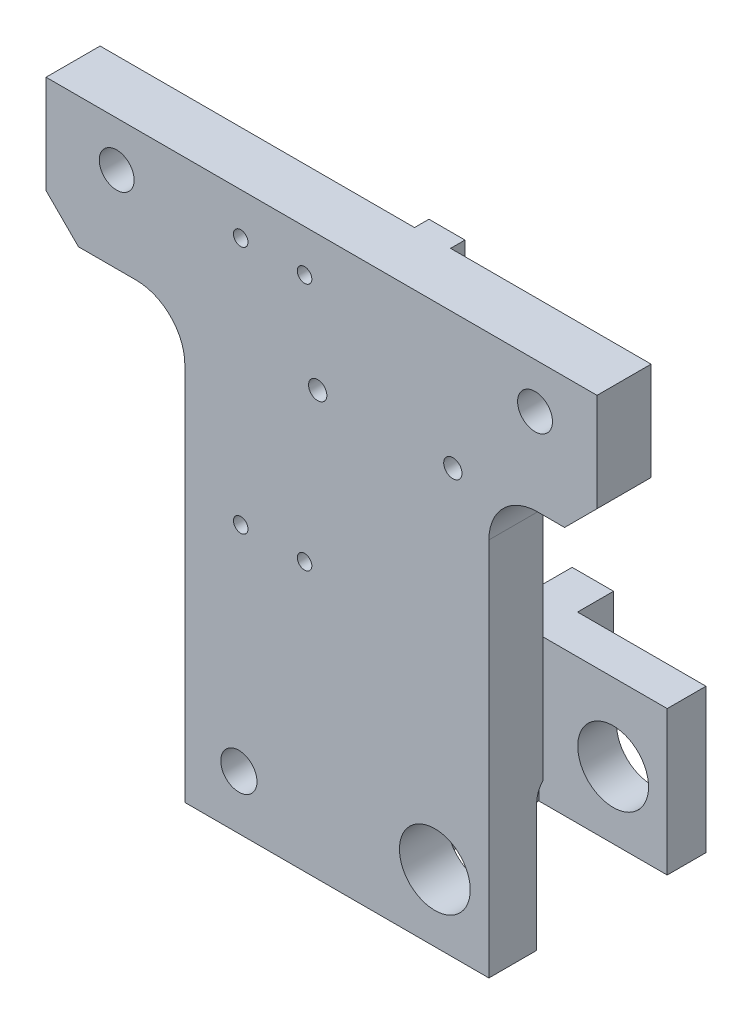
SolidWorks part; units mm, degrees
ref_plane "Front" through (0, 0, 0) normal (0, 0, 1) x (1, 0, 0)
ref_plane "Top" through (0, 0, 0) normal (0, 1, 0) x (1, 0, 0)
ref_plane "Right" through (0, 0, 0) normal (1, 0, 0) x (0, 0, -1)
sketch "Sketch1" plane through (0, 0, 0) normal (0, 0, 1) x (1, 0, 0)
  line L0 (-12.3787, 0) -> (-12.3787, 420) construction
  line L1 (-12.3787, 58.42) -> (30.48, 58.42)
  line L2 (-12.3787, 58.42) -> (-12.3787, -20.32)
  line L3 (-12.3787, -20.32) -> (30.48, -20.32)
  line L4 (30.48, 58.42) -> (30.48, -20.32)
  dimension "D1" = 58.42
  dimension "D2" = 20.32
  dimension "D3" = 30.48
extrude "Extrude1" add sketch "Sketch1" along normal blind 7.62
sketch "Sketch3" plane through (0, 0, 0) normal (0, 0, -1) x (-1, 0, 0)
  line L0 (12.3787, 58.42) -> (12.3787, -20.32) construction
  line L1 (12.3787, 0) -> (-12.3787, 0)
  line L2 (12.3787, 0) -> (12.3787, -20.32)
  line L3 (12.3787, -20.32) -> (-12.3787, -20.32)
  line L4 (-12.3787, 0) -> (-12.3787, -20.32)
  line L5 (12.3787, -20.32) -> (-30.48, -20.32) construction
  line L6 (-12.3787, 0) -> (-12.3787, 420) construction
  line L7 (-12.3787, 0) -> (12.3787, 0) construction
extrude "Extrude2" add sketch "Sketch3" along normal up to surface (17.511 mm away)
sketch "Sketch5" plane through (0, 0, 0) normal (0, 0, -1) x (-1, 0, 0)
  line L0 (-30.48, -20.32) -> (-30.48, 58.42) construction
  line L1 (-12.3787, -20.32) -> (-30.48, -20.32)
  line L2 (-12.3787, -20.32) -> (-12.3787, 0)
  line L3 (-12.3787, 0) -> (-30.48, 0)
  line L4 (-30.48, -20.32) -> (-30.48, 0)
  line L8 (12.3787, 0) -> (-12.3787, 0) construction
extrude "Cut-Extrude2" cut sketch "Sketch5" against normal blind 0.889
fillet "Fillet1" radius 3.556 1 edges at (21.4293, 0, 0.889)
sketch "Sketch4" plane through (0, 0, -17.511) normal (0, 0, -1) x (-1, 0, 0)
  line L0 (12.3787, 0) -> (-12.3787, 0) construction
  line L1 (12.3787, -20.32) -> (-30.48, -20.32)
  line L2 (12.3787, -20.32) -> (12.3787, 0)
  line L3 (12.3787, 0) -> (-30.48, 0)
  line L4 (-30.48, -20.32) -> (-30.48, 0)
  line L5 (-30.48, 0) -> (-30.48, 58.42) construction
extrude "Extrude3" add sketch "Sketch4" along normal blind 5.461
sketch "Sketch6" plane through (0, 0, 0) normal (0, 0, 1) x (1, 0, 0)
  line L1 (30.48, 58.42) -> (45.72, 58.42)
  line L2 (30.48, 58.42) -> (30.48, 40.005)
  line L3 (30.48, 40.005) -> (45.72, 40.005)
  line L4 (45.72, 58.42) -> (45.72, 40.005)
  dimension "D1" = 18.415
  dimension "D2" = 15.24
extrude "Extrude4" add sketch "Sketch6" along normal up to surface (7.62 mm away)
sketch "Sketch7" plane through (0, 0, 0) normal (0, 0, 1) x (1, 0, 0)
  line L0 (30.48, 40.005) -> (45.72, 40.005) construction
  line L1 (-12.3787, 58.42) -> (-31.9367, 58.42)
  line L2 (-12.3787, 58.42) -> (-12.3787, 40.005)
  line L3 (-12.3787, 40.005) -> (-31.9367, 40.005)
  line L4 (-31.9367, 58.42) -> (-31.9367, 40.005)
  dimension "D1" = 19.558
extrude "Extrude5" add sketch "Sketch7" along normal up to surface (7.62 mm away)
fillet "Fillet2" radius 6.858 2 edges at (30.48, 40.005, 3.81)
sketch "Sketch8" plane through (0, 0, -22.972) normal (0, 0, -1) x (-1, 0, 0)
  line L1 (12.3787, -20.32) -> (-6.0287, -20.32)
  line L2 (12.3787, -20.32) -> (12.3787, 0)
  line L3 (12.3787, 0) -> (-6.0287, 0)
  line L4 (-6.0287, -20.32) -> (-6.0287, 0)
  line L6 (-12.3787, 0) -> (-12.3787, -20.32) construction
  dimension "D1" = 6.35
extrude "Cut-Extrude3" cut sketch "Sketch8" against normal up to surface (19.772 mm away)
chamfer "Chamfer1" [suppressed] distance 5.08 angle 45
sketch "Sketch9" plane through (0, 0, 0) normal (0, 0, -1) x (-1, 0, 0)
  line L0 (-45.72, 58.42) -> (31.9367, 58.42) construction
  line L1 (-17.4587, 58.42) -> (-12.3787, 58.42)
  line L2 (-17.4587, 58.42) -> (-17.4587, 9.906)
  line L3 (-17.4587, 9.906) -> (-12.3787, 9.906)
  line L4 (-12.3787, 58.42) -> (-12.3787, 9.906)
  line L5 (-12.3787, 0) -> (-12.3787, 420) construction
  line L6 (12.3787, 0) -> (-12.3787, 0) construction
  dimension "D1" = 5.08
  dimension "D2" = 9.906
extrude "Extrude6" add sketch "Sketch9" along normal blind 2.032
sketch "Sketch10" plane through (0, 0, 7.62) normal (0, 0, 1) x (1, 0, 0)
  circle A0 centre (22.86, -10.89) radius 4.9911
  circle A1 centre (22.86, -10.89) radius 5 construction
  dimension "D1" = 9.9822
extrude "Cut-Extrude4" cut sketch "Sketch10" against normal through all
chamfer "Chamfer2" distance 4.572 angle 45 2 edges at (45.72, 40.005, 3.81) (-31.9367, 40.005, 3.81)
sketch "Sketch19" plane through (0, 0, -22.972) normal (0, 0, -1) x (-1, 0, 0)
  line L1 (-6.0287, 0) -> (-12.3787, 0)
  line L2 (-6.0287, 0) -> (-6.0287, -20.32)
  line L3 (-6.0287, -20.32) -> (-12.3787, -20.32)
  line L4 (-12.3787, 0) -> (-12.3787, -20.32)
extrude "Extrude7" add sketch "Sketch19" along normal blind 5.08
hole_wizard "#10 (0.1935) Diameter Hole1" positions "Sketch12" profile "Sketch11" hole size "#10" standard "Ansi Inch"
sketch "Sketch12" plane through (0, 0, 0) normal (0, 0, -1) x (-1, 0, 0)
  line L0 (-12.3787, 58.42) -> (31.9367, 58.42) construction
  line L1 (31.9367, 58.42) -> (31.9367, 44.577) construction
  line L2 (-45.72, 58.42) -> (-17.4587, 58.42) construction
  line L3 (-45.72, 44.577) -> (-45.72, 58.42) construction
  point P0 (21.9799, 52.07)
  point P1 (-36.9824, 52.07)
  dimension "D1" = 6.35
  dimension "D2" = 9.9568
  dimension "D3" = 6.35
  dimension "D4" = 8.7376
sketch "Sketch11" plane through (-21.9799, 52.07, 0) normal (1, 0, 0) x (0, 1, 0)
  line L0 (0, 0) -> (0, 7.62)
  line L1 (0, 7.62) -> (2.4574, 7.62)
  line L2 (2.4574, 7.62) -> (2.4574, 0)
  line L5 (2.4574, 0) -> (0, 0)
  line L11 (0, -6.35) -> (0, 107.95) construction
  dimension "Thru Hole Dia." = 4.9149
  dimension "Thru Hole Depth" = 7.62
hole_wizard "M2.5x0.45 Tapped Hole1" positions "Sketch14" profile "Sketch13" tap size "M2.5x0.45" standard "Ansi Metric"
sketch "Sketch14" plane through (0, 0, 0) normal (0, 0, -1) x (-1, 0, 0)
  circle A0 centre (4.5, 52.5) radius 1.45 construction
  circle A1 centre (-4.5, 52.5) radius 1.45 construction
  circle A2 centre (4.5, 17.5) radius 1.45 construction
  circle A3 centre (-4.5, 17.5) radius 1.45 construction
  point P0 (4.5, 52.5)
  point P1 (-4.5, 52.5)
  point P2 (-4.5, 17.5)
  point P3 (4.5, 17.5)
sketch "Sketch13" plane through (-4.5, 52.5, 0) normal (1, 0, 0) x (0, 1, 0)
  line L0 (0, 0) -> (0, 7.62)
  line L1 (0, 7.62) -> (1.025, 7.62)
  line L2 (1.025, 7.62) -> (1.025, 0)
  line L5 (1.025, 0) -> (0, 0)
  line L11 (0, -6.35) -> (0, 107.95) construction
  dimension "Thru Tap Drill Dia." = 2.05
  dimension "Thru Tap Drill Depth" = 7.62
hole_wizard "#5-40 Tapped Hole1" positions "Sketch16" profile "Sketch15" tap size "#5-40" standard "Ansi Inch"
sketch "Sketch16" plane through (6.0287, 0, 0) normal (-1, 0, 0) x (0, 0, 1)
  circle A1 centre (-6.3838, -4.445) radius 1.6319 construction
  circle A2 centre (-25.4338, -4.445) radius 1.6319 construction
  point P0 (-25.4338, -4.445)
  point P1 (-6.3838, -4.445)
sketch "Sketch15" plane through (6.0287, -4.445, -25.4338) normal (0, 1, 0) x (0, 0, 1)
  line L0 (0, 0) -> (0, 39.6913)
  line L1 (0, 39.6913) -> (1.289, 39.6913)
  line L2 (1.289, 39.6913) -> (1.289, 0)
  line L5 (1.289, 0) -> (0, 0)
  line L11 (0, -6.35) -> (0, 107.95) construction
  dimension "Thru Tap Drill Dia." = 2.5781
  dimension "Thru Tap Drill Depth" = 39.6913
hole_wizard "#4-40 Tapped Hole1" positions "Sketch18" profile "Sketch17" tap size "#4-40" standard "Ansi Inch"
sketch "Sketch18" plane through (-12.3787, 0, 0) normal (-1, 0, 0) x (0, 0, 1)
  circle A0 centre (4.445, -3.175) radius 1.4732 construction
  circle A1 centre (4.445, 13.335) radius 1.4732 construction
  circle A2 centre (4.445, 29.845) radius 1.4732 construction
  point P0 (4.445, -3.175)
  point P1 (4.445, 13.335)
  point P2 (4.445, 29.845)
sketch "Sketch17" plane through (-12.3787, -3.175, 4.445) normal (0, 1, 0) x (0, 0, 1)
  line L0 (0, 0) -> (0, 11.2202)
  line L1 (0, 11.2202) -> (1.1303, 10.541)
  line L2 (1.1303, 10.541) -> (1.1303, 0)
  line L5 (1.1303, 0) -> (0, 0)
  line L10 (0, 11.2202) -> (-1.1303, 10.541) construction
  line L11 (0, -6.35) -> (0, 107.95) construction
  dimension "Tap Drill Dia." = 2.2606
  dimension "Tap Drill Depth" = 10.541
  dimension "Drill Angle" = 118
hole_wizard "CBORE for #10 Socket Head Cap Screw1" positions "Sketch21" profile "Sketch20" counterbore size "#10" standard "Ansi Inch"
sketch "Sketch21" plane through (0, 0, -3.2) normal (0, 0, -1) x (-1, 0, 0)
  line L0 (-6.0287, -20.32) -> (12.3787, -20.32) construction
  line L1 (12.3787, -20.32) -> (12.3787, 0) construction
  point P0 (4.7587, -12.7)
  dimension "D1" = 7.62
  dimension "D2" = 7.62
sketch "Sketch20" plane through (-4.7587, -12.7, -3.2) normal (1, 0, 0) x (0, 1, 0)
  line L0 (0, 0) -> (0, 10.82)
  line L1 (0, 10.82) -> (2.5527, 10.82)
  line L3 (2.5527, 10.82) -> (2.5527, 5.842)
  line L4 (2.5527, 5.842) -> (4.7625, 5.842)
  line L5 (4.7625, 5.842) -> (4.7625, 0)
  line L7 (4.7625, 0) -> (0, 0)
  line L11 (0, -6.35) -> (0, 107.95) construction
  dimension "Thru Hole Dia." = 5.1054
  dimension "Thru Hole Depth" = 10.82
  dimension "C'Bore Dia." = 9.525
  dimension "C'Bore Depth" = 5.842
sketch "Sketch22" plane through (6.0287, 0, 0) normal (-1, 0, 0) x (0, 0, 1)
  line L1 (-3.2, 0) -> (-28.052, 0)
  line L2 (-3.2, 0) -> (-3.2, -20.32)
  line L3 (-3.2, -20.32) -> (-28.052, -20.32)
  line L4 (-28.052, 0) -> (-28.052, -20.32)
extrude "Cut-Extrude5" cut sketch "Sketch22" against normal blind 0.508
sketch "Sketch23" plane through (6.5367, 0, 0) normal (-1, 0, 0) x (0, 0, 1)
  line L1 (-13.1148, 0) -> (-9.0508, 0)
  line L2 (-13.1148, 0) -> (-13.1148, -8.255)
  line L3 (-13.1148, -8.255) -> (-9.0508, -8.255)
  line L4 (-9.0508, 0) -> (-9.0508, -8.255)
  line L6 (-9.5588, -1.27) -> (-9.5588, -7.62) construction
  line L7 (-3.4628, -7.62) -> (-9.5588, -7.62) construction
  line L8 (-3.2, 0) -> (-28.052, 0) construction
  dimension "D1" = 4.064
  dimension "D2" = 0.635
  dimension "D3" = 0.508
extrude "Cut-Extrude6" cut sketch "Sketch23" against normal through all
fillet "Fillet3" radius 1.778 2 edges at (9.4577, -8.255, -13.1148) (9.4577, -8.255, -9.0508)
sketch "Sketch24" plane through (0, 0, -3.2) normal (0, 0, -1) x (-1, 0, 0)
  line L0 (-6.5367, -20.32) -> (-6.5367, 0) construction
  line L1 (-6.5367, -20.32) -> (-3.2347, -20.32)
  line L2 (-6.5367, -20.32) -> (-6.5367, -12.065)
  line L3 (-6.5367, -12.065) -> (-3.2347, -12.065)
  line L4 (-3.2347, -20.32) -> (-3.2347, -12.065)
  line L5 (-6.5367, -20.32) -> (12.3787, -20.32) construction
  dimension "D1" = 8.255
  dimension "D2" = 3.302
extrude "Extrude8" add sketch "Sketch24" along normal up to surface (24.852 mm away)
fillet "Fillet4" radius 3.556 1 edges at (6.5367, -12.065, -15.626)
sketch "Sketch25" plane through (12.3787, 0, 0) normal (1, 0, 0) x (0, 0, -1)
  line L0 (17.511, -20.32) -> (-0.889, -20.32) construction
  line L1 (9.0508, -20.32) -> (13.1148, -20.32)
  line L2 (9.0508, -20.32) -> (9.0508, 0)
  line L3 (9.0508, 0) -> (13.1148, 0)
  line L4 (13.1148, -20.32) -> (13.1148, 0)
  line L5 (13.1148, 0) -> (13.1148, -6.477) construction
  line L6 (9.0508, -6.477) -> (9.0508, 0) construction
  line L7 (17.511, 0) -> (13.1148, 0) construction
extrude "Cut-Extrude7" cut sketch "Sketch25" against normal blind 3.81
hole_wizard "#5-40 Tapped Hole2" positions "3DSketch1" profile "Sketch26" tap size "#5-40" standard "Ansi Inch"
sketch3d "3DSketch1"
  line L0 (45.72, 44.577, 7.62) -> (45.72, 58.42, 7.62) construction
  line L1 (45.72, 58.42, 7.62) -> (-31.9367, 58.42, 7.62) construction
  point P0 (25.4, 39.37, 7.62)
  point P2 (6.35, 39.37, 7.62)
  dimension "D1" = 20.32
  dimension "D2" = 19.05
  dimension "D3" = 19.05
sketch "Sketch26" plane through (25.4, 39.37, 7.62) normal (1, 0, 0) x (0, -1, 0)
  line L0 (0, 0) -> (0, 10.2995)
  line L1 (0, 10.2995) -> (1.289, 9.525)
  line L2 (1.289, 9.525) -> (1.289, 0)
  line L5 (1.289, 0) -> (0, 0)
  line L10 (0, 10.2995) -> (-1.289, 9.525) construction
  line L11 (0, -6.35) -> (0, 107.95) construction
  dimension "Tap Drill Dia." = 2.5781
  dimension "Tap Drill Depth" = 9.525
  dimension "Drill Angle" = 118
